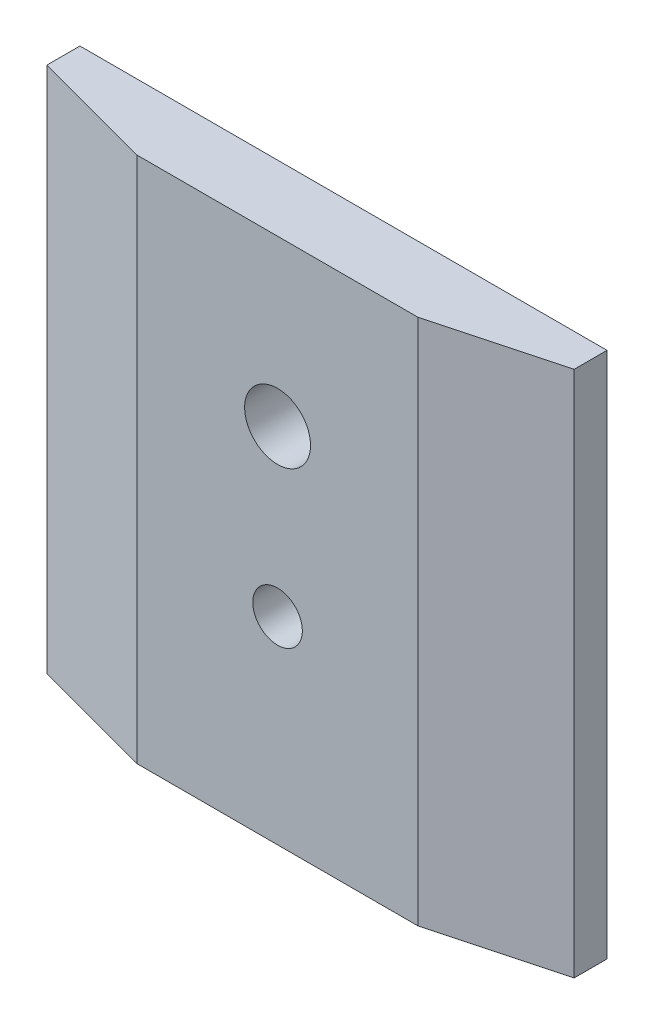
SolidWorks part; units mm, degrees
ref_plane "Front Plane" through (0, 0, 0) normal (0, 0, 1) x (1, 0, 0)
ref_plane "Top Plane" through (0, 0, 0) normal (0, 1, 0) x (1, 0, 0)
ref_plane "Right Plane" through (0, 0, 0) normal (1, 0, 0) x (0, 0, -1)
sketch "Sketch1" plane through (0, 0, 0) normal (0, 0, 1) x (1, 0, 0)
  line L0 (0, 0) -> (0, 25.4) construction
  line L1 (-25.4, -25.4) -> (25.4, -25.4)
  line L2 (25.4, -25.4) -> (25.4, 25.4)
  line L3 (25.4, 25.4) -> (-25.4, 25.4)
  line L4 (-25.4, 25.4) -> (-25.4, -25.4)
  circle A0 centre (0, -6.35) radius 2.3876
  circle A1 centre (0, 9.525) radius 3.175
  dimension "D6" = 6.35
  dimension "D7" = 4.7752
  dimension "D1" = 25.4
  dimension "D2" = 50.8
  dimension "D3" = 25.4
  dimension "D4" = 9.525
  dimension "D5" = 6.35
sketch "Sketch2" plane through (0, 0, 0) normal (0, 0, 1) x (1, 0, 0)
  line L0 (-25.4, -25.4) -> (25.4, -25.4) construction
  line L1 (25.4, -25.4) -> (25.4, 25.4) construction
  line L2 (25.4, 25.4) -> (-25.4, 25.4) construction
  line L3 (-25.4, 25.4) -> (-25.4, -25.4) construction
  line L4 (-25.4, -25.4) -> (25.4, -25.4)
  line L5 (25.4, -25.4) -> (25.4, 25.4)
  line L6 (25.4, 25.4) -> (-25.4, 25.4)
  line L7 (-25.4, 25.4) -> (-25.4, -25.4)
  circle A0 centre (0, -6.35) radius 2.3876 construction
  circle A1 centre (0, 9.525) radius 3.175 construction
  circle A2 centre (0, -6.35) radius 2.3876
  circle A3 centre (0, 9.525) radius 3.175
extrude "Boss-Extrude1" add sketch "Sketch2" along normal blind 6.35
chamfer "Chamfer1" distance 3.175 angle 75 1 edges at (25.4, 0, 6.35)
chamfer "Chamfer2" distance 3.175 angle 75 1 edges at (-25.4, 0, 6.35)
